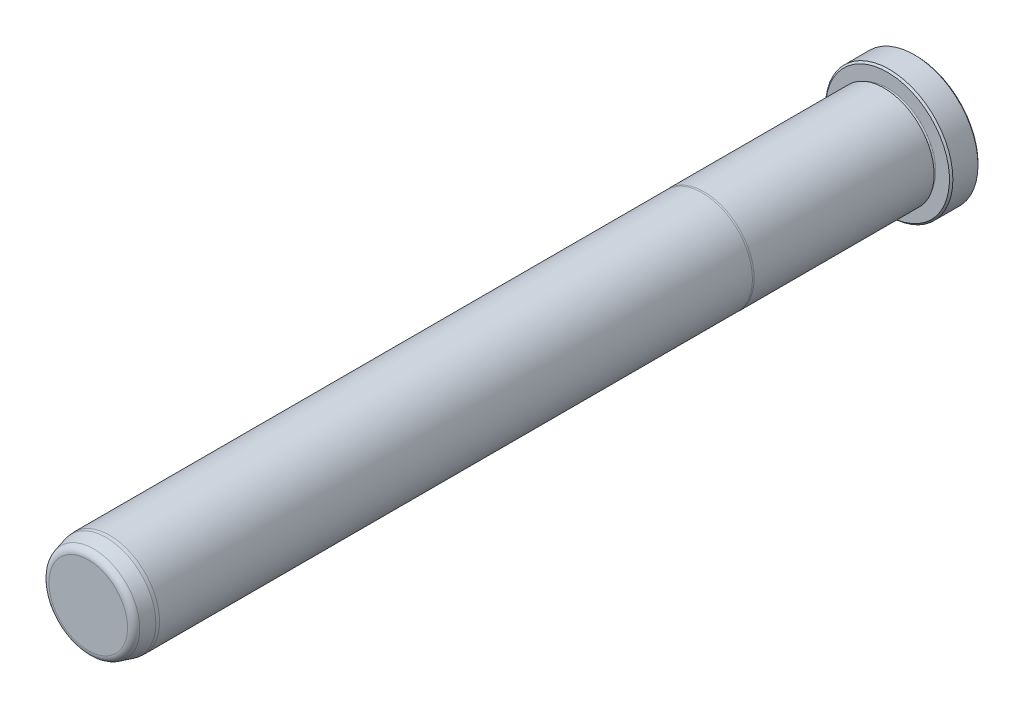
SolidWorks part; units mm, degrees
ref_plane "Front Plane" through (0, 0, 0) normal (0, 0, 1) x (1, 0, 0)
ref_plane "Top Plane" through (0, 0, 0) normal (0, 1, 0) x (1, 0, 0)
ref_plane "Right Plane" through (0, 0, 0) normal (1, 0, 0) x (0, 0, -1)
sketch "Sketch1" plane through (0, 0, 0) normal (1, 0, 0) x (0, 0, -1)
  line L0 (0, 0) -> (0, 14.1605)
  line L1 (0, 14.1605) -> (-6.35, 14.1605)
  line L2 (-6.35, 14.1605) -> (-6.35, 10.7188)
  line L3 (-6.35, 10.3378) -> (-7.112, 10.3378) construction
  line L4 (-7.112, 10.7188) -> (-7.112, 11.1252)
  line L5 (-7.112, 11.1252) -> (-47.1348, 11.1252)
  line L6 (-47.1348, 11.1252) -> (-47.498, 11.0998)
  line L7 (-47.498, 11.0998) -> (-179.3875, 11.0998)
  line L9 (-184.15, 9.9612) -> (-184.15, 0)
  line L10 (-184.15, 0) -> (0, 0)
  line L11 (0, 0) -> (13.6287, 0) construction
  line L12 (-179.3875, 11.0998) -> (-180.1495, 11.0331)
  line L13 (-180.1495, 11.0331) -> (-184.15, 9.9612)
  arc A0 (-7.112, 10.7188) -> (-6.35, 10.7188) centre (-6.731, 10.7188) ccw
  dimension "D14" = 0.762
  dimension "D1" = 6.35
  dimension "D2" = 0.762
  dimension "D3" = 28.321
  dimension "D4" = 22.2504
  dimension "D5" = 47.498
  dimension "D6" = 184.15
  dimension "D7" = 0.7874
  dimension "D8" = 4
  dimension "D9" = 22.1996
  dimension "D10" = 5
  dimension "D11" = 15
  dimension "D12" = 0.762
  dimension "D13" = 4.7625
revolve "Revolve1" add sketch "Sketch1" angle 360 about L11
fillet "Fillet6" radius 1.5875 1 edges at (9.9612, 0, 184.15)
chamfer "Chamfer1" distance 0.381 angle 45 2 edges at (14.1605, 0, 0) (14.1605, 0, 6.35)
